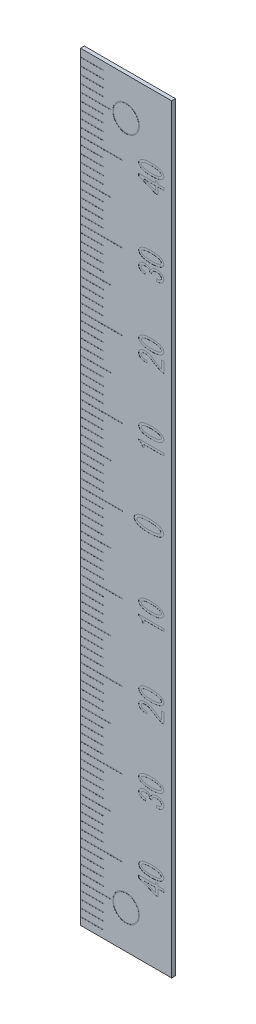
SolidWorks part; units mm, degrees
ref_plane "Front" through (0, 0, 0) normal (0, 0, 1) x (1, 0, 0)
ref_plane "Top" through (0, 0, 0) normal (0, 1, 0) x (1, 0, 0)
ref_plane "Right" through (0, 0, 0) normal (1, 0, 0) x (0, 0, -1)
sketch "Sketch1" plane through (0, 0, 0) normal (0, 0, 1) x (1, 0, 0)
  line L1 (0, 0) -> (0, 100)
  line L2 (0, 0) -> (12, 0)
  line L3 (12, 0) -> (12, 100)
  line L4 (0, 100) -> (12, 100)
  dimension "D1" = 100
  dimension "D2" = 12
extrude "Extrude1" add sketch "Sketch1" along normal blind 0.5
sketch "Sketch2" plane through (0, 0, 0.5) normal (0, 0, 1) x (1, 0, 0)
  line L0 (0, 100) -> (0, 0) construction
  line L1 (0, 0) -> (12, 0) construction
  line L2 (12, 100) -> (0, 100) construction
  circle A0 centre (6, 5) radius 1.75
  circle A1 centre (6, 95) radius 1.75
  circle A2 centre (6, 5) radius 1.65
  circle A3 centre (6, 95) radius 1.65
  dimension "D1" = 6
  dimension "D2" = 6
  dimension "D3" = 5
  dimension "D4" = 5
  dimension "D5" = 3.5
  dimension "D6" = 3.5
  dimension "D7" = 0.1
extrude "Extrude2" cut sketch "Sketch2" against normal blind 0.01
sketch "Sketch3" plane through (0, 0, 0.5) normal (0, 0, 1) x (1, 0, 0)
  line L0 (12, 100) -> (0, 100) construction
  line L1 (7.5, 88.25) -> (11, 88.25) construction
  line L2 (7.5, 88.25) -> (7.5, 91.75) construction
  line L3 (7.5, 91.75) -> (11, 91.75) construction
  line L4 (11, 88.25) -> (11, 91.75) construction
  line L6 (11, 78.25) -> (11, 81.75) construction
  line L7 (11, 68.25) -> (11, 71.75) construction
  line L8 (11, 58.25) -> (11, 61.75) construction
  line L9 (11, 49.125) -> (11, 52.625) construction
  line L10 (11, 38.25) -> (11, 41.75) construction
  line L11 (11, 28.25) -> (11, 31.75) construction
  line L12 (11, 18.25) -> (11, 21.75) construction
  line L13 (11, 8.25) -> (11, 11.75) construction
  line L14 (8.2751, 50) -> (-8.2751, 50) construction
  line L15 (8.2751, 40) -> (-8.2751, 40) construction
  line L16 (12, 0) -> (12, 100) construction
  line L17 (8.2751, 30) -> (-8.2751, 30) construction
  line L18 (8.2751, 20) -> (-8.2751, 20) construction
  line L19 (8.2751, 10) -> (-8.2751, 10) construction
  line L20 (8.2751, 60) -> (-8.2751, 60) construction
  line L21 (8.2751, 70) -> (-8.2751, 70) construction
  line L22 (8.2751, 80) -> (-8.2751, 80) construction
  line L23 (8.2751, 90) -> (-8.2751, 90) construction
  text T0 "40" font "ＭＳ ゴシック" height in points 11
  text T1 "30" font "ＭＳ ゴシック" height in points 11
  text T2 "20" font "ＭＳ ゴシック" height in points 11
  text T3 "10" font "ＭＳ ゴシック" height in points 11
  text T4 "0" font "ＭＳ ゴシック" height in points 13
  text T5 "10  " font "ＭＳ ゴシック" height in points 11
  text T6 "20" font "ＭＳ ゴシック" height in points 11
  text T7 "30" font "ＭＳ ゴシック" height in points 11
  text T8 "40" font "ＭＳ ゴシック" height in points 11
  point P4 (11, 90)
  point P36 (0, 50)
  dimension "D1" = 3.5
  dimension "D2" = 10
  dimension "D3" = 1
  dimension "D4" = 3.5
  dimension "D7" = 5
  dimension "D9" = 0.875
  dimension "D6" = 1
  dimension "D5" = 4
  dimension "D8" = 5
extrude "Extrude3" cut sketch "Sketch3" against normal blind 0.01
sketch "Sketch4" plane through (0, 0, 0.5) normal (0, 0, 1) x (1, 0, 0)
  line L5 (12, 100) -> (0, 100) construction
  line L406 (6, 100) -> (6, 0) construction
  line L407 (0, 0) -> (12, 0) construction
  line L408 (3, 1.05) -> (3, 0.95)
  line L409 (0, 0.95) -> (3, 0.95)
  line L410 (0, 1.05) -> (3, 1.05)
  line L411 (0, 1.05) -> (0, 0.95)
  line L412 (3, 2.05) -> (3, 1.95)
  line L413 (0, 1.95) -> (3, 1.95)
  line L414 (0, 2.05) -> (3, 2.05)
  line L415 (0, 2.05) -> (0, 1.95)
  line L416 (3, 3.05) -> (3, 2.95)
  line L417 (0, 2.95) -> (3, 2.95)
  line L418 (0, 3.05) -> (3, 3.05)
  line L419 (0, 3.05) -> (0, 2.95)
  line L420 (3, 4.05) -> (3, 3.95)
  line L421 (0, 3.95) -> (3, 3.95)
  line L422 (0, 4.05) -> (3, 4.05)
  line L423 (0, 4.05) -> (0, 3.95)
  line L424 (3, 6.05) -> (3, 5.95)
  line L425 (0, 5.95) -> (3, 5.95)
  line L426 (0, 6.05) -> (3, 6.05)
  line L427 (0, 6.05) -> (0, 5.95)
  line L428 (3, 7.05) -> (3, 6.95)
  line L429 (0, 6.95) -> (3, 6.95)
  line L430 (0, 7.05) -> (3, 7.05)
  line L431 (0, 7.05) -> (0, 6.95)
  line L432 (3, 8.05) -> (3, 7.95)
  line L433 (0, 7.95) -> (3, 7.95)
  line L434 (0, 8.05) -> (3, 8.05)
  line L435 (3, 9.05) -> (3, 8.95)
  line L436 (0, 8.95) -> (3, 8.95)
  line L437 (0, 9.05) -> (0, 8.95)
  line L438 (0, 9.05) -> (3, 9.05)
  line L439 (4, 4.95) -> (4, 5.05)
  line L440 (0, 5.05) -> (4, 5.05)
  line L441 (0, 4.95) -> (0, 5.05)
  line L442 (0, 4.95) -> (4, 4.95)
  line L443 (0, 8.05) -> (0, 7.95)
  line L444 (0, 9.95) -> (0, 10.05)
  line L445 (5.5, 9.95) -> (0, 9.95)
  line L446 (5.5, 10.05) -> (5.5, 9.95)
  line L447 (0, 10.05) -> (5.5, 10.05)
  line L448 (3, 11.05) -> (3, 10.95)
  line L449 (0, 10.95) -> (3, 10.95)
  line L450 (0, 11.05) -> (3, 11.05)
  line L451 (0, 11.05) -> (0, 10.95)
  line L452 (3, 12.05) -> (3, 11.95)
  line L453 (0, 11.95) -> (3, 11.95)
  line L454 (0, 12.05) -> (3, 12.05)
  line L455 (0, 12.05) -> (0, 11.95)
  line L456 (3, 13.05) -> (3, 12.95)
  line L457 (0, 12.95) -> (3, 12.95)
  line L458 (0, 13.05) -> (3, 13.05)
  line L459 (0, 13.05) -> (0, 12.95)
  line L460 (3, 14.05) -> (3, 13.95)
  line L461 (0, 13.95) -> (3, 13.95)
  line L462 (0, 14.05) -> (3, 14.05)
  line L463 (0, 14.05) -> (0, 13.95)
  line L464 (3, 16.05) -> (3, 15.95)
  line L465 (0, 15.95) -> (3, 15.95)
  line L466 (0, 16.05) -> (3, 16.05)
  line L467 (0, 16.05) -> (0, 15.95)
  line L468 (3, 17.05) -> (3, 16.95)
  line L469 (0, 16.95) -> (3, 16.95)
  line L470 (0, 17.05) -> (3, 17.05)
  line L471 (0, 17.05) -> (0, 16.95)
  line L472 (3, 18.05) -> (3, 17.95)
  line L473 (0, 17.95) -> (3, 17.95)
  line L474 (0, 18.05) -> (3, 18.05)
  line L475 (3, 19.05) -> (3, 18.95)
  line L476 (0, 18.95) -> (3, 18.95)
  line L477 (0, 19.05) -> (0, 18.95)
  line L478 (0, 19.05) -> (3, 19.05)
  line L479 (4, 14.95) -> (4, 15.05)
  line L480 (0, 15.05) -> (4, 15.05)
  line L481 (0, 14.95) -> (0, 15.05)
  line L482 (0, 14.95) -> (4, 14.95)
  line L483 (0, 18.05) -> (0, 17.95)
  line L484 (0, 19.95) -> (0, 20.05)
  line L485 (5.5, 19.95) -> (0, 19.95)
  line L486 (5.5, 20.05) -> (5.5, 19.95)
  line L487 (0, 20.05) -> (5.5, 20.05)
  line L488 (3, 21.05) -> (3, 20.95)
  line L489 (0, 20.95) -> (3, 20.95)
  line L490 (0, 21.05) -> (3, 21.05)
  line L491 (0, 21.05) -> (0, 20.95)
  line L492 (3, 22.05) -> (3, 21.95)
  line L493 (0, 21.95) -> (3, 21.95)
  line L494 (0, 22.05) -> (3, 22.05)
  line L495 (0, 22.05) -> (0, 21.95)
  line L496 (3, 23.05) -> (3, 22.95)
  line L497 (0, 22.95) -> (3, 22.95)
  line L498 (0, 23.05) -> (3, 23.05)
  line L499 (0, 23.05) -> (0, 22.95)
  line L500 (3, 24.05) -> (3, 23.95)
  line L501 (0, 23.95) -> (3, 23.95)
  line L502 (0, 24.05) -> (3, 24.05)
  line L503 (0, 24.05) -> (0, 23.95)
  line L504 (3, 26.05) -> (3, 25.95)
  line L505 (0, 25.95) -> (3, 25.95)
  line L506 (0, 26.05) -> (3, 26.05)
  line L507 (0, 26.05) -> (0, 25.95)
  line L508 (3, 27.05) -> (3, 26.95)
  line L509 (0, 26.95) -> (3, 26.95)
  line L510 (0, 27.05) -> (3, 27.05)
  line L511 (0, 27.05) -> (0, 26.95)
  line L512 (3, 28.05) -> (3, 27.95)
  line L513 (0, 27.95) -> (3, 27.95)
  line L514 (0, 28.05) -> (3, 28.05)
  line L515 (3, 29.05) -> (3, 28.95)
  line L516 (0, 28.95) -> (3, 28.95)
  line L517 (0, 29.05) -> (0, 28.95)
  line L518 (0, 29.05) -> (3, 29.05)
  line L519 (4, 24.95) -> (4, 25.05)
  line L520 (0, 25.05) -> (4, 25.05)
  line L521 (0, 24.95) -> (0, 25.05)
  line L522 (0, 24.95) -> (4, 24.95)
  line L523 (0, 28.05) -> (0, 27.95)
  line L524 (0, 29.95) -> (0, 30.05)
  line L525 (5.5, 29.95) -> (0, 29.95)
  line L526 (5.5, 30.05) -> (5.5, 29.95)
  line L527 (0, 30.05) -> (5.5, 30.05)
  line L528 (3, 31.05) -> (3, 30.95)
  line L529 (0, 30.95) -> (3, 30.95)
  line L530 (0, 31.05) -> (3, 31.05)
  line L531 (0, 31.05) -> (0, 30.95)
  line L532 (3, 32.05) -> (3, 31.95)
  line L533 (0, 31.95) -> (3, 31.95)
  line L534 (0, 32.05) -> (3, 32.05)
  line L535 (0, 32.05) -> (0, 31.95)
  line L536 (3, 33.05) -> (3, 32.95)
  line L537 (0, 32.95) -> (3, 32.95)
  line L538 (0, 33.05) -> (3, 33.05)
  line L539 (0, 33.05) -> (0, 32.95)
  line L540 (3, 34.05) -> (3, 33.95)
  line L541 (0, 33.95) -> (3, 33.95)
  line L542 (0, 34.05) -> (3, 34.05)
  line L543 (0, 34.05) -> (0, 33.95)
  line L544 (3, 36.05) -> (3, 35.95)
  line L545 (0, 35.95) -> (3, 35.95)
  line L546 (0, 36.05) -> (3, 36.05)
  line L547 (0, 36.05) -> (0, 35.95)
  line L548 (3, 37.05) -> (3, 36.95)
  line L549 (0, 36.95) -> (3, 36.95)
  line L550 (0, 37.05) -> (3, 37.05)
  line L551 (0, 37.05) -> (0, 36.95)
  line L552 (3, 38.05) -> (3, 37.95)
  line L553 (0, 37.95) -> (3, 37.95)
  line L554 (0, 38.05) -> (3, 38.05)
  line L555 (3, 39.05) -> (3, 38.95)
  line L556 (0, 38.95) -> (3, 38.95)
  line L557 (0, 39.05) -> (0, 38.95)
  line L558 (0, 39.05) -> (3, 39.05)
  line L559 (4, 34.95) -> (4, 35.05)
  line L560 (0, 35.05) -> (4, 35.05)
  line L561 (0, 34.95) -> (0, 35.05)
  line L562 (0, 34.95) -> (4, 34.95)
  line L563 (0, 38.05) -> (0, 37.95)
  line L564 (0, 39.95) -> (0, 40.05)
  line L565 (5.5, 39.95) -> (0, 39.95)
  line L566 (5.5, 40.05) -> (5.5, 39.95)
  line L567 (0, 40.05) -> (5.5, 40.05)
  line L568 (3, 41.05) -> (3, 40.95)
  line L569 (0, 40.95) -> (3, 40.95)
  line L570 (0, 41.05) -> (3, 41.05)
  line L571 (0, 41.05) -> (0, 40.95)
  line L572 (3, 42.05) -> (3, 41.95)
  line L573 (0, 41.95) -> (3, 41.95)
  line L574 (0, 42.05) -> (3, 42.05)
  line L575 (0, 42.05) -> (0, 41.95)
  line L576 (3, 43.05) -> (3, 42.95)
  line L577 (0, 42.95) -> (3, 42.95)
  line L578 (0, 43.05) -> (3, 43.05)
  line L579 (0, 43.05) -> (0, 42.95)
  line L580 (3, 44.05) -> (3, 43.95)
  line L581 (0, 43.95) -> (3, 43.95)
  line L582 (0, 44.05) -> (3, 44.05)
  line L583 (0, 44.05) -> (0, 43.95)
  line L584 (3, 46.05) -> (3, 45.95)
  line L585 (0, 45.95) -> (3, 45.95)
  line L586 (0, 46.05) -> (3, 46.05)
  line L587 (0, 46.05) -> (0, 45.95)
  line L588 (3, 47.05) -> (3, 46.95)
  line L589 (0, 46.95) -> (3, 46.95)
  line L590 (0, 47.05) -> (3, 47.05)
  line L591 (0, 47.05) -> (0, 46.95)
  line L592 (3, 48.05) -> (3, 47.95)
  line L593 (0, 47.95) -> (3, 47.95)
  line L594 (0, 48.05) -> (3, 48.05)
  line L595 (3, 49.05) -> (3, 48.95)
  line L596 (0, 48.95) -> (3, 48.95)
  line L597 (0, 49.05) -> (0, 48.95)
  line L598 (0, 49.05) -> (3, 49.05)
  line L599 (4, 44.95) -> (4, 45.05)
  line L600 (0, 45.05) -> (4, 45.05)
  line L601 (0, 44.95) -> (0, 45.05)
  line L602 (0, 44.95) -> (4, 44.95)
  line L603 (0, 48.05) -> (0, 47.95)
  line L604 (3, 51.05) -> (3, 50.95)
  line L605 (0, 50.95) -> (3, 50.95)
  line L606 (0, 51.05) -> (3, 51.05)
  line L607 (0, 51.05) -> (0, 50.95)
  line L608 (3, 52.05) -> (3, 51.95)
  line L609 (0, 51.95) -> (3, 51.95)
  line L610 (0, 52.05) -> (3, 52.05)
  line L611 (0, 52.05) -> (0, 51.95)
  line L612 (3, 53.05) -> (3, 52.95)
  line L613 (0, 52.95) -> (3, 52.95)
  line L614 (0, 53.05) -> (3, 53.05)
  line L615 (0, 53.05) -> (0, 52.95)
  line L616 (3, 54.05) -> (3, 53.95)
  line L617 (0, 53.95) -> (3, 53.95)
  line L618 (0, 54.05) -> (3, 54.05)
  line L619 (0, 54.05) -> (0, 53.95)
  line L620 (3, 56.05) -> (3, 55.95)
  line L621 (0, 55.95) -> (3, 55.95)
  line L622 (0, 56.05) -> (3, 56.05)
  line L623 (0, 56.05) -> (0, 55.95)
  line L624 (3, 57.05) -> (3, 56.95)
  line L625 (0, 56.95) -> (3, 56.95)
  line L626 (0, 57.05) -> (3, 57.05)
  line L627 (0, 57.05) -> (0, 56.95)
  line L628 (3, 58.05) -> (3, 57.95)
  line L629 (0, 57.95) -> (3, 57.95)
  line L630 (0, 58.05) -> (3, 58.05)
  line L631 (3, 59.05) -> (3, 58.95)
  line L632 (0, 58.95) -> (3, 58.95)
  line L633 (0, 59.05) -> (0, 58.95)
  line L634 (0, 59.05) -> (3, 59.05)
  line L635 (4, 54.95) -> (4, 55.05)
  line L636 (0, 55.05) -> (4, 55.05)
  line L637 (0, 54.95) -> (0, 55.05)
  line L638 (0, 54.95) -> (4, 54.95)
  line L639 (0, 58.05) -> (0, 57.95)
  line L640 (0, 49.95) -> (0, 50.05)
  line L641 (5.5, 49.95) -> (0, 49.95)
  line L642 (5.5, 50.05) -> (5.5, 49.95)
  line L643 (0, 50.05) -> (5.5, 50.05)
  line L644 (3, 61.05) -> (3, 60.95)
  line L645 (0, 60.95) -> (3, 60.95)
  line L646 (0, 61.05) -> (3, 61.05)
  line L647 (0, 61.05) -> (0, 60.95)
  line L648 (3, 62.05) -> (3, 61.95)
  line L649 (0, 61.95) -> (3, 61.95)
  line L650 (0, 62.05) -> (3, 62.05)
  line L651 (0, 62.05) -> (0, 61.95)
  line L652 (3, 63.05) -> (3, 62.95)
  line L653 (0, 62.95) -> (3, 62.95)
  line L654 (0, 63.05) -> (3, 63.05)
  line L655 (0, 63.05) -> (0, 62.95)
  line L656 (3, 64.05) -> (3, 63.95)
  line L657 (0, 63.95) -> (3, 63.95)
  line L658 (0, 64.05) -> (3, 64.05)
  line L659 (0, 64.05) -> (0, 63.95)
  line L660 (3, 66.05) -> (3, 65.95)
  line L661 (0, 65.95) -> (3, 65.95)
  line L662 (0, 66.05) -> (3, 66.05)
  line L663 (0, 66.05) -> (0, 65.95)
  line L664 (3, 67.05) -> (3, 66.95)
  line L665 (0, 66.95) -> (3, 66.95)
  line L666 (0, 67.05) -> (3, 67.05)
  line L667 (0, 67.05) -> (0, 66.95)
  line L668 (3, 68.05) -> (3, 67.95)
  line L669 (0, 67.95) -> (3, 67.95)
  line L670 (0, 68.05) -> (3, 68.05)
  line L671 (3, 69.05) -> (3, 68.95)
  line L672 (0, 68.95) -> (3, 68.95)
  line L673 (0, 69.05) -> (0, 68.95)
  line L674 (0, 69.05) -> (3, 69.05)
  line L675 (4, 64.95) -> (4, 65.05)
  line L676 (0, 65.05) -> (4, 65.05)
  line L677 (0, 64.95) -> (0, 65.05)
  line L678 (0, 64.95) -> (4, 64.95)
  line L679 (0, 68.05) -> (0, 67.95)
  line L680 (0, 59.95) -> (0, 60.05)
  line L681 (5.5, 59.95) -> (0, 59.95)
  line L682 (5.5, 60.05) -> (5.5, 59.95)
  line L683 (0, 60.05) -> (5.5, 60.05)
  line L684 (3, 71.05) -> (3, 70.95)
  line L685 (0, 70.95) -> (3, 70.95)
  line L686 (0, 71.05) -> (3, 71.05)
  line L687 (0, 71.05) -> (0, 70.95)
  line L688 (3, 72.05) -> (3, 71.95)
  line L689 (0, 71.95) -> (3, 71.95)
  line L690 (0, 72.05) -> (3, 72.05)
  line L691 (0, 72.05) -> (0, 71.95)
  line L692 (3, 73.05) -> (3, 72.95)
  line L693 (0, 72.95) -> (3, 72.95)
  line L694 (0, 73.05) -> (3, 73.05)
  line L695 (0, 73.05) -> (0, 72.95)
  line L696 (3, 74.05) -> (3, 73.95)
  line L697 (0, 73.95) -> (3, 73.95)
  line L698 (0, 74.05) -> (3, 74.05)
  line L699 (0, 74.05) -> (0, 73.95)
  line L700 (3, 76.05) -> (3, 75.95)
  line L701 (0, 75.95) -> (3, 75.95)
  line L702 (0, 76.05) -> (3, 76.05)
  line L703 (0, 76.05) -> (0, 75.95)
  line L704 (3, 77.05) -> (3, 76.95)
  line L705 (0, 76.95) -> (3, 76.95)
  line L706 (0, 77.05) -> (3, 77.05)
  line L707 (0, 77.05) -> (0, 76.95)
  line L708 (3, 78.05) -> (3, 77.95)
  line L709 (0, 77.95) -> (3, 77.95)
  line L710 (0, 78.05) -> (3, 78.05)
  line L711 (3, 79.05) -> (3, 78.95)
  line L712 (0, 78.95) -> (3, 78.95)
  line L713 (0, 79.05) -> (0, 78.95)
  line L714 (0, 79.05) -> (3, 79.05)
  line L715 (4, 74.95) -> (4, 75.05)
  line L716 (0, 75.05) -> (4, 75.05)
  line L717 (0, 74.95) -> (0, 75.05)
  line L718 (0, 74.95) -> (4, 74.95)
  line L719 (0, 78.05) -> (0, 77.95)
  line L720 (0, 69.95) -> (0, 70.05)
  line L721 (5.5, 69.95) -> (0, 69.95)
  line L722 (5.5, 70.05) -> (5.5, 69.95)
  line L723 (0, 70.05) -> (5.5, 70.05)
  line L724 (3, 81.05) -> (3, 80.95)
  line L725 (0, 80.95) -> (3, 80.95)
  line L726 (0, 81.05) -> (3, 81.05)
  line L727 (0, 81.05) -> (0, 80.95)
  line L728 (3, 82.05) -> (3, 81.95)
  line L729 (0, 81.95) -> (3, 81.95)
  line L730 (0, 82.05) -> (3, 82.05)
  line L731 (0, 82.05) -> (0, 81.95)
  line L732 (3, 83.05) -> (3, 82.95)
  line L733 (0, 82.95) -> (3, 82.95)
  line L734 (0, 83.05) -> (3, 83.05)
  line L735 (0, 83.05) -> (0, 82.95)
  line L736 (3, 84.05) -> (3, 83.95)
  line L737 (0, 83.95) -> (3, 83.95)
  line L738 (0, 84.05) -> (3, 84.05)
  line L739 (0, 84.05) -> (0, 83.95)
  line L740 (3, 86.05) -> (3, 85.95)
  line L741 (0, 85.95) -> (3, 85.95)
  line L742 (0, 86.05) -> (3, 86.05)
  line L743 (0, 86.05) -> (0, 85.95)
  line L744 (3, 87.05) -> (3, 86.95)
  line L745 (0, 86.95) -> (3, 86.95)
  line L746 (0, 87.05) -> (3, 87.05)
  line L747 (0, 87.05) -> (0, 86.95)
  line L748 (3, 88.05) -> (3, 87.95)
  line L749 (0, 87.95) -> (3, 87.95)
  line L750 (0, 88.05) -> (3, 88.05)
  line L751 (3, 89.05) -> (3, 88.95)
  line L752 (0, 88.95) -> (3, 88.95)
  line L753 (0, 89.05) -> (0, 88.95)
  line L754 (0, 89.05) -> (3, 89.05)
  line L755 (4, 84.95) -> (4, 85.05)
  line L756 (0, 85.05) -> (4, 85.05)
  line L757 (0, 84.95) -> (0, 85.05)
  line L758 (0, 84.95) -> (4, 84.95)
  line L759 (0, 88.05) -> (0, 87.95)
  line L760 (3, 91.05) -> (3, 90.95)
  line L761 (0, 90.95) -> (3, 90.95)
  line L762 (0, 91.05) -> (3, 91.05)
  line L763 (0, 91.05) -> (0, 90.95)
  line L764 (3, 92.05) -> (3, 91.95)
  line L765 (0, 91.95) -> (3, 91.95)
  line L766 (0, 92.05) -> (3, 92.05)
  line L767 (0, 92.05) -> (0, 91.95)
  line L768 (3, 93.05) -> (3, 92.95)
  line L769 (0, 92.95) -> (3, 92.95)
  line L770 (0, 93.05) -> (3, 93.05)
  line L771 (0, 93.05) -> (0, 92.95)
  line L772 (3, 94.05) -> (3, 93.95)
  line L773 (0, 93.95) -> (3, 93.95)
  line L774 (0, 94.05) -> (3, 94.05)
  line L775 (0, 94.05) -> (0, 93.95)
  line L776 (0, 79.95) -> (0, 80.05)
  line L777 (5.5, 79.95) -> (0, 79.95)
  line L778 (5.5, 80.05) -> (5.5, 79.95)
  line L779 (0, 80.05) -> (5.5, 80.05)
  line L780 (3, 96.05) -> (3, 95.95)
  line L781 (0, 95.95) -> (3, 95.95)
  line L782 (0, 96.05) -> (3, 96.05)
  line L783 (0, 96.05) -> (0, 95.95)
  line L784 (3, 97.05) -> (3, 96.95)
  line L785 (0, 96.95) -> (3, 96.95)
  line L786 (0, 97.05) -> (3, 97.05)
  line L787 (0, 97.05) -> (0, 96.95)
  line L788 (3, 98.05) -> (3, 97.95)
  line L789 (0, 97.95) -> (3, 97.95)
  line L790 (0, 98.05) -> (3, 98.05)
  line L791 (3, 99.05) -> (3, 98.95)
  line L792 (0, 98.95) -> (3, 98.95)
  line L793 (0, 99.05) -> (0, 98.95)
  line L794 (0, 99.05) -> (3, 99.05)
  line L795 (4, 94.95) -> (4, 95.05)
  line L796 (0, 95.05) -> (4, 95.05)
  line L797 (0, 94.95) -> (0, 95.05)
  line L798 (0, 94.95) -> (4, 94.95)
  line L799 (0, 98.05) -> (0, 97.95)
  line L800 (0, 89.95) -> (0, 90.05)
  line L801 (5.5, 89.95) -> (0, 89.95)
  line L802 (5.5, 90.05) -> (5.5, 89.95)
  line L803 (0, 90.05) -> (5.5, 90.05)
extrude "Extrude4" cut sketch "Sketch4" against normal blind 0.01
move or copy body "Body-Move/Copy2" bodies to move or copy 105 copy no translate (-12, -50, 0)
